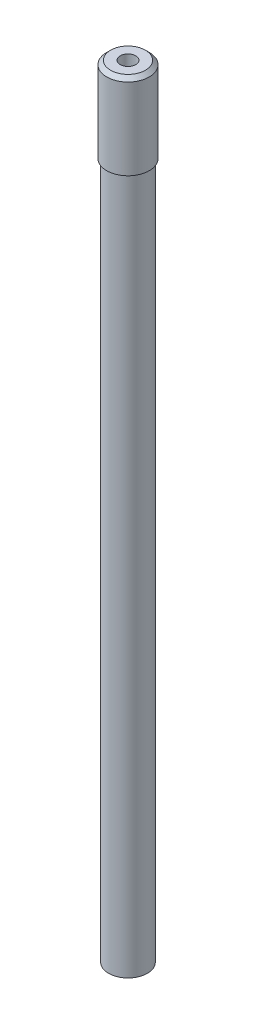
SolidWorks part; units mm, degrees
ref_plane "Plan de face" through (0, 0, 0) normal (0, 0, 1) x (1, 0, 0)
ref_plane "Plan de dessus" through (0, 0, 0) normal (0, 1, 0) x (1, 0, 0)
ref_plane "Plan de droite" through (0, 0, 0) normal (1, 0, 0) x (0, 0, -1)
sketch "Esquisse1" plane through (0, 0, 0) normal (0, 1, 0) x (1, 0, 0)
  circle A0 centre (0, 0) radius 2.75
  dimension "D1" = 5.5
extrude "Boss.-Extru.1" add sketch "Esquisse1" along normal blind 11
chamfer "Chanfrein1" distance 0.5 angle 45 1 edges at (0, 11, 2.75)
sketch "Esquisse2" plane through (0, 0, 0) normal (0, -1, 0) x (1, 0, 0)
  circle A0 centre (0, 0) radius 2.5
  dimension "D1" = 5
extrude "Boss.-Extru.2" add sketch "Esquisse2" along normal blind 90
sketch "Esquisse3" plane through (0, 11, 0) normal (0, 1, 0) x (1, 0, 0)
  circle A0 centre (0, 0) radius 1
  dimension "D1" = 2
extrude "Enlèv. mat.-Extru.1" cut sketch "Esquisse3" against normal through all
